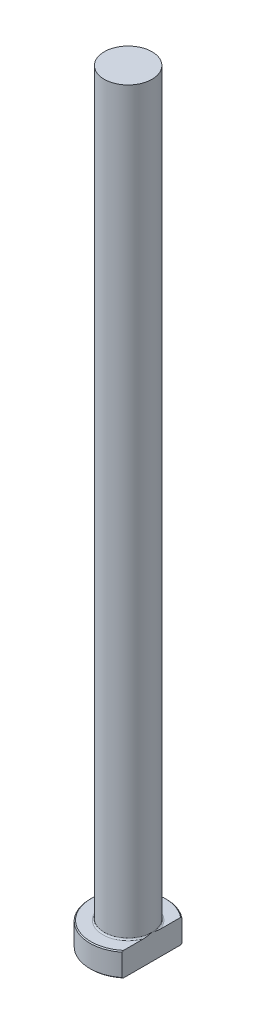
SolidWorks part; units mm, degrees
ref_plane "Front Plane" through (0, 0, 0) normal (0, 0, 1) x (1, 0, 0)
ref_plane "Top Plane" through (0, 0, 0) normal (0, 1, 0) x (1, 0, 0)
ref_plane "Right Plane" through (0, 0, 0) normal (1, 0, 0) x (0, 0, -1)
sketch "Sketch1" plane through (0, 0, 0) normal (0, 0, 1) x (1, 0, 0)
  line L0 (0, 259.9588) -> (0, -15.1925) construction
  line L1 (0, 0) -> (-8, 0)
  line L2 (-8, 0) -> (-8, 5)
  line L3 (-8, 5) -> (-5, 5)
  line L4 (-5, 5) -> (-5, 160)
  line L5 (-5, 160) -> (0, 160)
  line L6 (0, 160) -> (0, 0)
  dimension "L" = 160
  dimension "H" = 16
  dimension "T" = 5
  dimension "D" = 10
revolve "Revolve1" add sketch "Sketch1" angle 360 about L0
chamfer "Chamfer1" distance 0.2 angle 45 2 edges at (0, 5, 8) (0, 0, 8)
fillet "Fillet1" radius 0.3 1 edges at (0, 5, 5)
sketch "Sketch2" plane through (0, 0, 0) normal (0, 1, 0) x (1, 0, 0)
  line L0 (5, 6.245) -> (5, -6.245)
  circle A0 centre (0, 0) radius 8 construction
  arc A1 (5, -6.245) -> (5, 6.245) centre (0, 0) ccw
  circle A2 centre (0, 0) radius 5 construction
extrude "KEY" cut sketch "Sketch2" along normal through all
